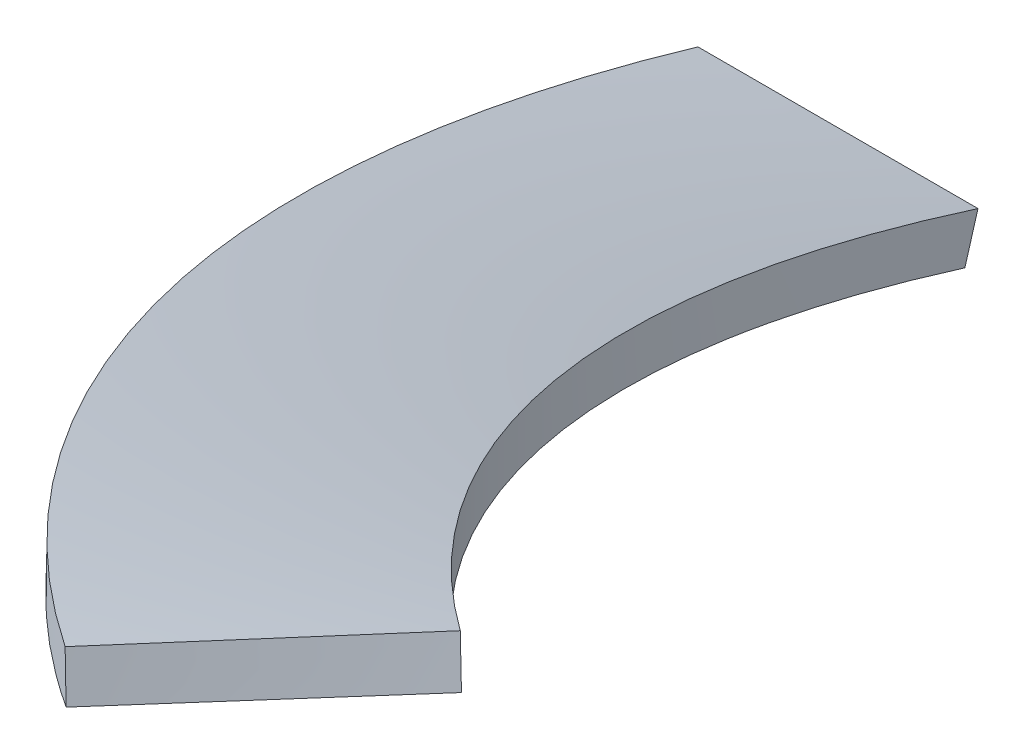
SolidWorks part; units mm, degrees
ref_plane "Ebene vorne" through (0, 0, 0) normal (0, 0, 1) x (1, 0, 0)
ref_plane "Ebene oben" through (0, 0, 0) normal (0, 1, 0) x (1, 0, 0)
ref_plane "Ebene rechts" through (0, 0, 0) normal (1, 0, 0) x (0, 0, -1)
sketch "Skizze1" plane through (0, 0, 0) normal (0, 0, 1) x (1, 0, 0)
  line L4 (-270, 0) -> (-330, 0)
  line L5 (-330, 0) -> (-330, -10)
  line L6 (-330, -10) -> (-270, -10)
  line L7 (-270, -10) -> (-270, 0)
  line L8 (-270, 0) -> (-330, 0)
  line L9 (-330, 0) -> (-330, -10)
  line L10 (-330, -10) -> (-270, -10)
  line L11 (-270, -10) -> (-270, 0)
  dimension "D1" = 0
sketch "Skizze2" plane through (0, 0, 0) normal (0, 0, 1) x (1, 0, 0)
  line L0 (0, 0) -> (0, -222.4718) construction
ref_plane "Ebene1" through (0, 0, 0) normal (0.7547, 0, 0.6561) x (0.6561, 0, -0.7547)
sketch "Skizze3" plane through (0, 0, 0) normal (0.7547, 0, 0.6561) x (0.6561, 0, -0.7547)
  line L0 (0, 0) -> (0, -222.4718) construction
  line L1 (-330, 70) -> (-270, 70)
  line L2 (-330, 70) -> (-330, 60)
  line L3 (-330, 60) -> (-270, 60)
  line L4 (-270, 70) -> (-270, 60)
  line L5 (-269.0793, -10) -> (-198.6804, -10) construction
  dimension "D1" = 270
  dimension "D2" = 60
  dimension "D3" = 10
  dimension "D4" = 80
sketch3d "3D-Skizze2"
  line L4 (0, 0, 0) -> (190.9188, -10, -190.9188) construction
sketch3d "3D-Skizze8"
  line L0 (-216.4995, 70, 249.0542) -> (0, 0, 0) construction
  line L1 (0, 0, 0) -> (-330, 0, 0) construction
  arc A0 (-330, 0, 0) -> (-216.4995, 70, 249.0542) centre (-28.2708, 25.5302, 15.5454) ccw
  point P3 (-49.3535, 319.0861, -57.3545)
sketch3d "3D-Skizze9"
  line L0 (-270, 0, 0) -> (0, 0, 0) construction
  line L1 (0, 0, 0) -> (-177.1359, 70, 203.7716) construction
  arc A0 (-270, 0, 0) -> (-177.1359, 70, 203.7716) centre (1.435, 28.0512, 1.7331) ccw
  point P3 (-24.9759, 288.395, -75.6646)
lofted bend "Ausgeformte Biegungen2" parameters "D1"=0, "D12"=10
other "Freiform-Biegung2" parameters "D1"=1000, "D4"=57.296, "D5"=2
sheet metal parameters "Blech1" parameters "D1"=3, "Dicke"=10
flat pattern "Abwicklung2"
sketch "Biegung-Linien2" plane through (-10.3715, 56.6674, -9.0158) normal (0.1779, -0.9718, 0.1546) x (0.9841, 0.1757, -0.0279)
other "Abwickeln-<Freiform-Biegung2>1"
